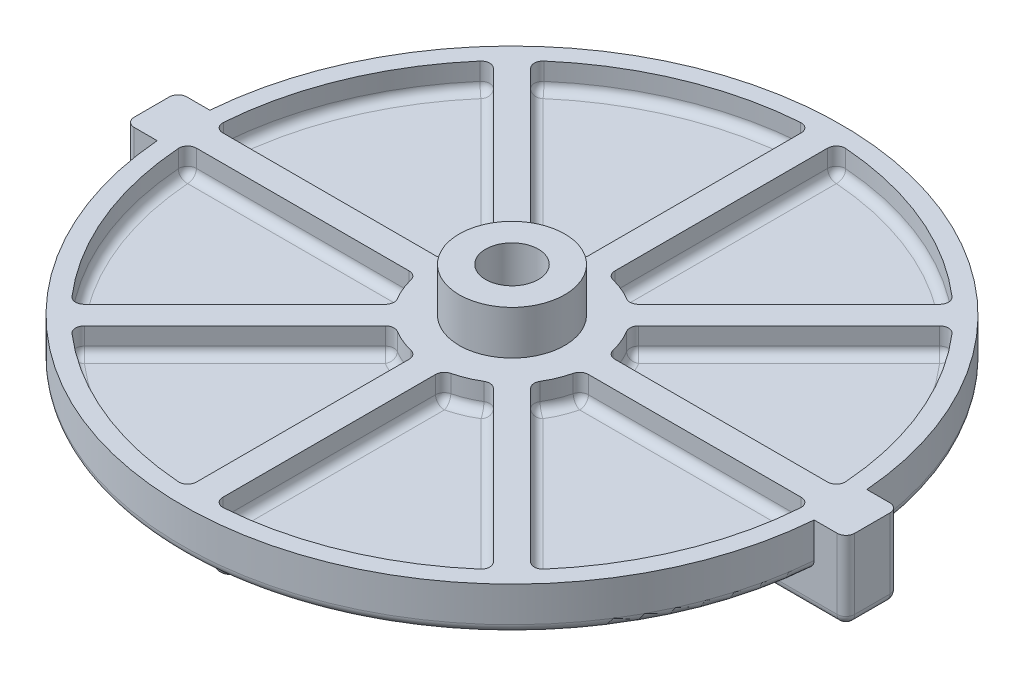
SolidWorks part; units mm, degrees
ref_plane "Front Plane" through (0, 0, 0) normal (0, 0, 1) x (1, 0, 0)
ref_plane "Top Plane" through (0, 0, 0) normal (0, 1, 0) x (1, 0, 0)
ref_plane "Right Plane" through (0, 0, 0) normal (1, 0, 0) x (0, 0, -1)
sketch "Sketch1" plane through (0, 0, 0) normal (0, 1, 0) x (1, 0, 0)
  circle A0 centre (0, 0) radius 37.5
  dimension "D1" = 75
extrude "Boss-Extrude1" add sketch "Sketch1" along normal blind 5
shell "Shell1" thickness 2
sketch "Sketch2" plane through (0, 2, 0) normal (0, 1, 0) x (1, 0, 0)
  circle A0 centre (0, 0) radius 9.5
  dimension "D1" = 19
extrude "Boss-Extrude2" add sketch "Sketch2" along normal up to surface (3 mm away)
sketch "Sketch3" plane through (0, 5, 0) normal (0, 1, 0) x (1, 0, 0)
  circle A0 centre (0, 0) radius 6
  dimension "D1" = 12
extrude "Boss-Extrude3" add sketch "Sketch3" along normal blind 5
sketch "Sketch4" plane through (0, 5, 0) normal (0, 1, 0) x (1, 0, 0)
  line L0 (0, 0) -> (35.5, 0)
  circle A0 centre (0, 0) radius 35.5 construction
rib "Rib1" sketch "Sketch4" sketch "Sketch4" thickness 3 extrusion direction normal to sketch draft on no parameters "D1"=3
pattern_circular "CirPattern1" count 8 over 360 about axis through (0, 0, 0) along (0, 1, 0) of "Rib1"
sketch "Sketch5" plane through (0, 0, 0) normal (0, -1, 0) x (1, 0, 0)
  line L0 (0, -17) -> (0, -32) construction
  line L1 (1.5, -17) -> (1.5, -32)
  line L2 (-1.5, -17) -> (-1.5, -32)
  line L3 (1.5, -35.4683) -> (1.5, -9.3808) construction
  arc A0 (1.5, -17) -> (-1.5, -17) centre (0, -17) ccw
  arc A1 (-1.5, -32) -> (1.5, -32) centre (0, -32) ccw
  circle A2 centre (0, 0) radius 32 construction
  point P3 (0, -24.5)
  dimension "D2" = 64
  dimension "D1" = 15
extrude "Boss-Extrude4" add sketch "Sketch5" along normal blind 4
mirror "Mirror1" about plane through (0, 0, 0) normal (0, 0, 1) of "Boss-Extrude4"
sketch "Sketch6" plane through (0, 0, 0) normal (0, -1, 0) x (1, 0, 0)
  line L0 (0, 0) -> (37.5, 0) construction
  line L1 (0, 0) -> (0, 40.6224) construction
  line L2 (-41, 3) -> (41, 3)
  line L3 (-41, 3) -> (-41, -3)
  line L4 (-41, -3) -> (41, -3)
  line L5 (41, 3) -> (41, -3)
  circle A0 centre (0, 0) radius 37.5 construction
  dimension "D1" = 82
  dimension "D2" = 6
extrude "Boss-Extrude5" add sketch "Sketch6" along normal up to surface (4 mm away)
sketch "Sketch7" plane through (0, 0, 0) normal (0, 1, 0) x (1, 0, 0)
  line L3 (41, 3) -> (37.3798, 3)
  line L4 (37.3798, -3) -> (41, -3)
  line L5 (41, -3) -> (41, 3)
  line L6 (41, 3) -> (37.3798, 3)
  line L7 (37.3798, -3) -> (41, -3)
  line L8 (41, -3) -> (41, 3)
  arc A1 (37.3798, -3) -> (37.3798, 3) centre (0, 0) ccw
  arc A2 (37.3798, -3) -> (37.3798, 3) centre (0, 0) ccw
  dimension "D1" = 0
extrude "Boss-Extrude6" add sketch "Sketch7" along normal up to surface (5 mm away)
sketch "Sketch8" plane through (0, 0, 0) normal (0, 1, 0) x (1, 0, 0)
  line L3 (-41, -3) -> (-37.3798, -3)
  line L4 (-37.3798, 3) -> (-41, 3)
  line L5 (-41, 3) -> (-41, -3)
  line L6 (-41, -3) -> (-37.3798, -3)
  line L7 (-37.3798, 3) -> (-41, 3)
  line L8 (-41, 3) -> (-41, -3)
  arc A1 (-37.3798, 3) -> (-37.3798, -3) centre (0, 0) ccw
  arc A2 (-37.3798, 3) -> (-37.3798, -3) centre (0, 0) ccw
  dimension "D1" = 0
extrude "Boss-Extrude7" add sketch "Sketch8" along normal up to surface (5 mm away)
hole_wizard "Ø6.0 (6) Diameter Hole1" positions "Sketch10" profile "Sketch9" hole size "Ø6.0" standard "ANSI Metric"
sketch "Sketch10" plane through (0, 10, 0) normal (0, 1, 0) x (1, 0, 0)
  point P0 (0, 0)
sketch "Sketch9" plane through (0, 10, 0) normal (1, 0, 0) x (0, 0, 1)
  line L0 (0, 0) -> (0, 9.8026)
  line L1 (0, 9.8026) -> (3, 8)
  line L2 (3, 8) -> (3, 0)
  line L5 (3, 0) -> (0, 0)
  line L10 (0, 9.8026) -> (-3, 8) construction
  line L11 (0, -6.35) -> (0, 107.95) construction
  dimension "Hole Dia." = 6
  dimension "Hole Depth" = 8
  dimension "Drill Angle" = 118
fillet "Fillet3" radius 1 32 edges at (-26.1405, 3.5, -24.0192) (-35.4683, 3.5, -1.5) (-9.3808, 3.5, -1.5) (-7.6939, 3.5, -5.5726) (-1.5, 3.5, -35.4683) (-24.0192, 3.5, -26.1405) (-5.5726, 3.5, -7.6939) (-1.5, 3.5, -9.3808) (35.4683, 3.5, 1.5) (9.3808, 3.5, 1.5) (7.6939, 3.5, 5.5726) (26.1405, 3.5, 24.0192) (24.0192, 3.5, 26.1405) (5.5726, 3.5, 7.6939) (1.5, 3.5, 9.3808) (1.5, 3.5, 35.4683) (-1.5, 3.5, 35.4683) (-1.5, 3.5, 9.3808) (-5.5726, 3.5, 7.6939) (-24.0192, 3.5, 26.1405) (35.4683, 3.5, -1.5) (26.1405, 3.5, -24.0192) (7.6939, 3.5, -5.5726) (-7.6939, 3.5, 5.5726) (-9.3808, 3.5, 1.5) (-35.4683, 3.5, 1.5) (-26.1405, 3.5, 24.0192) (24.0192, 3.5, -26.1405) (1.5, 3.5, -35.4683) (1.5, 3.5, -9.3808) (5.5726, 3.5, -7.6939) (9.3808, 3.5, -1.5)
fillet "Fillet4" radius 1 64 edges at (26.1351, 2, -23.5626) (32.7977, 2, -13.5853) (35.1416, 2, -1.819) (22.3037, 2, -1.5) (9.5808, 2, -1.7132) (8.7769, 2, -3.6355) (7.9861, 2, -5.5632) (1.819, 2, -35.1416) (13.5853, 2, -32.7977) (23.5626, 2, -26.1351) (5.5632, 2, -7.9861) (3.6355, 2, -8.7769) (1.7132, 2, -9.5808) (-23.5626, 2, -26.1351) (-13.5853, 2, -32.7977) (-1.819, 2, -35.1416) (-1.7132, 2, -9.5808) (-3.6355, 2, -8.7769) (-5.5632, 2, -7.9861) (-35.1416, 2, -1.819) (-32.7977, 2, -13.5853) (-26.1351, 2, -23.5626) (-7.9861, 2, -5.5632) (-8.7769, 2, -3.6355) (-9.5808, 2, -1.7132) (-26.1351, 2, 23.5626) (-32.7977, 2, 13.5853) (-35.1416, 2, 1.819) (-9.5808, 2, 1.7132) (-8.7769, 2, 3.6355) (-7.9861, 2, 5.5632) (-1.819, 2, 35.1416) (-13.5853, 2, 32.7977) (-23.5626, 2, 26.1351) (-5.5632, 2, 7.9861) (-3.6355, 2, 8.7769) (-1.7132, 2, 9.5808) (23.5626, 2, 26.1351) (13.5853, 2, 32.7977) (1.819, 2, 35.1416) (1.7132, 2, 9.5808) (3.6355, 2, 8.7769) (5.5632, 2, 7.9861) (26.1351, 2, 23.5626) (32.7977, 2, 13.5853) (35.1416, 2, 1.819) (22.3037, 2, 1.5) (9.5808, 2, 1.7132) (8.7769, 2, 3.6355) (7.9861, 2, 5.5632) (16.8317, 2, -14.7104) (14.7104, 2, -16.8317) (1.5, 2, -22.3037) (-1.5, 2, -22.3037) (-14.7104, 2, -16.8317) (-16.8317, 2, -14.7104) (-22.3037, 2, -1.5) (-22.3037, 2, 1.5) (-16.8317, 2, 14.7104) (-14.7104, 2, 16.8317) (-1.5, 2, 22.3037) (1.5, 2, 22.3037) (14.7104, 2, 16.8317) (16.8317, 2, 14.7104)
fillet "Fillet5" radius 1 2 edges at (41, -4, 0) (-41, -4, 0)
fillet "Fillet6" radius 1 28 edges at (-41, 1, -3) (-40.7071, -3.7071, -3) (41, 1, -3) (40.7071, -3.7071, -3) (41, 1, 3) (40.7071, -3.7071, 3) (-41, 1, 3) (-40.7071, -3.7071, 3) (0, -4, -33.5) (1.5, -4, -24.5) (0, -4, -15.5) (-1.5, -4, -24.5) (0, 0, -15.5) (1.5, 0, -24.5) (0, 0, -33.5) (-1.5, 0, -24.5) (0, -4, 15.5) (1.5, -4, 24.5) (0, -4, 33.5) (-1.5, -4, 24.5) (0, 0, 33.5) (1.5, 0, 24.5) (0, 0, 15.5) (-1.5, 0, 24.5) (0, -4, -3) (0, -4, 3) (0, 0, -37.5) (0, 0, 37.5)
